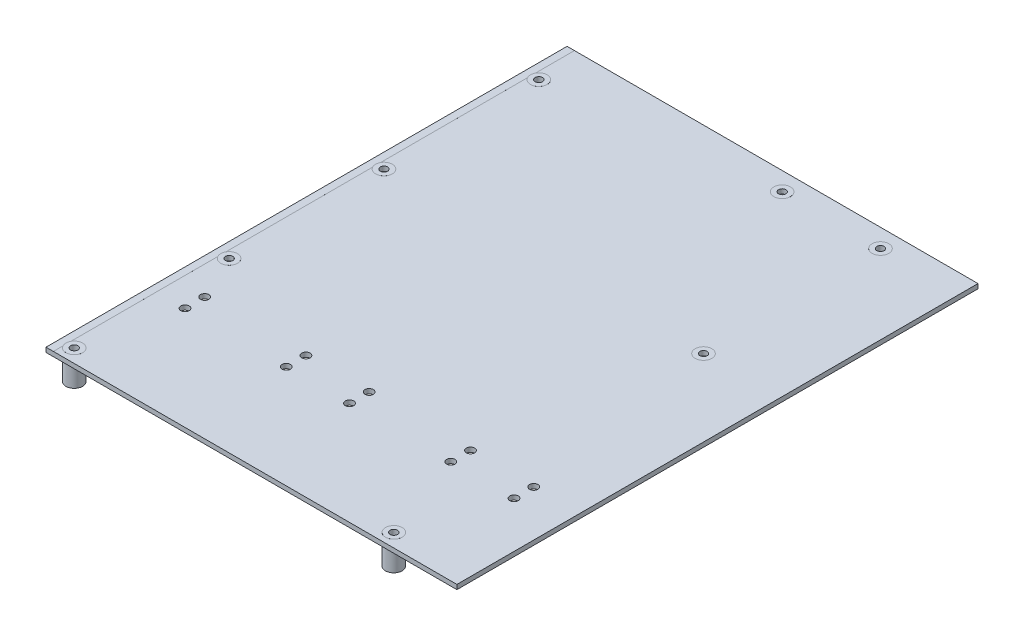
SolidWorks part; units mm, degrees
ref_plane "Front Plane" through (0, 0, 0) normal (0, 0, 1) x (1, 0, 0)
ref_plane "Top Plane" through (0, 0, 0) normal (0, 1, 0) x (1, 0, 0)
ref_plane "Right Plane" through (0, 0, 0) normal (1, 0, 0) x (0, 0, -1)
imported_body "Imported1"
sketch "Sketch1" plane through (0, -0.0127, 0) normal (0, -1, 0) x (1, 0, 0)
  circle A0 centre (165.1, 22.225) radius 1.905 construction
  circle A1 centre (165.1, 22.225) radius 4.318 construction
  circle A2 centre (165.1, 22.225) radius 1.905
  circle A3 centre (165.1, 22.225) radius 4.318
  circle A4 centre (-165.1, 22.225) radius 1.905 construction
  circle A5 centre (-165.1, 22.225) radius 4.318 construction
  circle A6 centre (-165.1, 22.225) radius 1.905
  circle A7 centre (-165.1, 22.225) radius 4.318
  circle A8 centre (-165.1, 262.255) radius 1.905 construction
  circle A9 centre (-165.1, 262.255) radius 4.318 construction
  circle A10 centre (-165.1, 262.255) radius 1.905
  circle A11 centre (-165.1, 262.255) radius 4.318
  circle A12 centre (165.1, 262.255) radius 1.905 construction
  circle A13 centre (165.1, 262.255) radius 4.318 construction
  circle A14 centre (165.1, 262.255) radius 1.905
  circle A15 centre (165.1, 262.255) radius 4.318
  circle A16 centre (-1.27, 9.525) radius 1.905 construction
  circle A17 centre (-1.27, 9.525) radius 4.318 construction
  circle A18 centre (-1.27, 9.525) radius 1.905
  circle A19 centre (-1.27, 9.525) radius 4.318
  circle A20 centre (0, 262.255) radius 1.905 construction
  circle A21 centre (0, 262.255) radius 4.318 construction
  circle A22 centre (0, 262.255) radius 1.905
  circle A23 centre (0, 262.255) radius 4.318
extrude "Extrude1" add sketch "Sketch1" along normal blind 12.7
sketch "Sketch2" plane through (0, 2.3622, 0) normal (0, 1, 0) x (-1, 0, 0)
  line L0 (-132.7089, -35.0186) -> (-132.7089, 350.451)
extrude "Cut-Extrude-Thin1" cut sketch "Sketch2" against normal through all and the other way through all thin
move or copy body "Body-Move/Copy1" bodies to move or copy 104 copy no translate (79.1672, 0, 0)
sketch "Sketch3" plane through (130.1689, 0, 0) normal (1, 0, 0) x (0, 0, -1)
  line L4 (-269.24, 0) -> (0, 0)
  line L5 (0, 0) -> (0, 2.3622)
  line L6 (0, 2.3622) -> (-269.24, 2.3622)
  line L7 (-269.24, 2.3622) -> (-269.24, 0)
  line L8 (-269.24, 0) -> (0, 0)
  line L9 (0, 0) -> (0, 2.3622)
  line L10 (0, 2.3622) -> (-269.24, 2.3622)
  line L11 (-269.24, 2.3622) -> (-269.24, 0)
  dimension "D1" = 0
extrude "Extrude2" add sketch "Sketch3" along normal up to vertex
sketch "Sketch4" plane through (0, 2.3622, 0) normal (0, 1, 0) x (1, 0, 0)
  line L0 (248.0772, 0) -> (-168.91, 0) construction
  line L1 (-172.72, -269.24) -> (39.5836, -269.24)
  line L2 (-172.72, -269.24) -> (-172.72, 0)
  line L3 (-172.72, 0) -> (39.5836, 0)
  line L4 (39.5836, -269.24) -> (39.5836, 0)
  line L5 (-172.72, -269.24) -> (39.5836, 0) construction
  line L6 (-172.72, 0) -> (39.5836, -269.24) construction
  point P0 (-66.5682, -134.62)
extrude "Extrude3" cut sketch "Sketch4" against normal blind 25.4 flip side to cut
